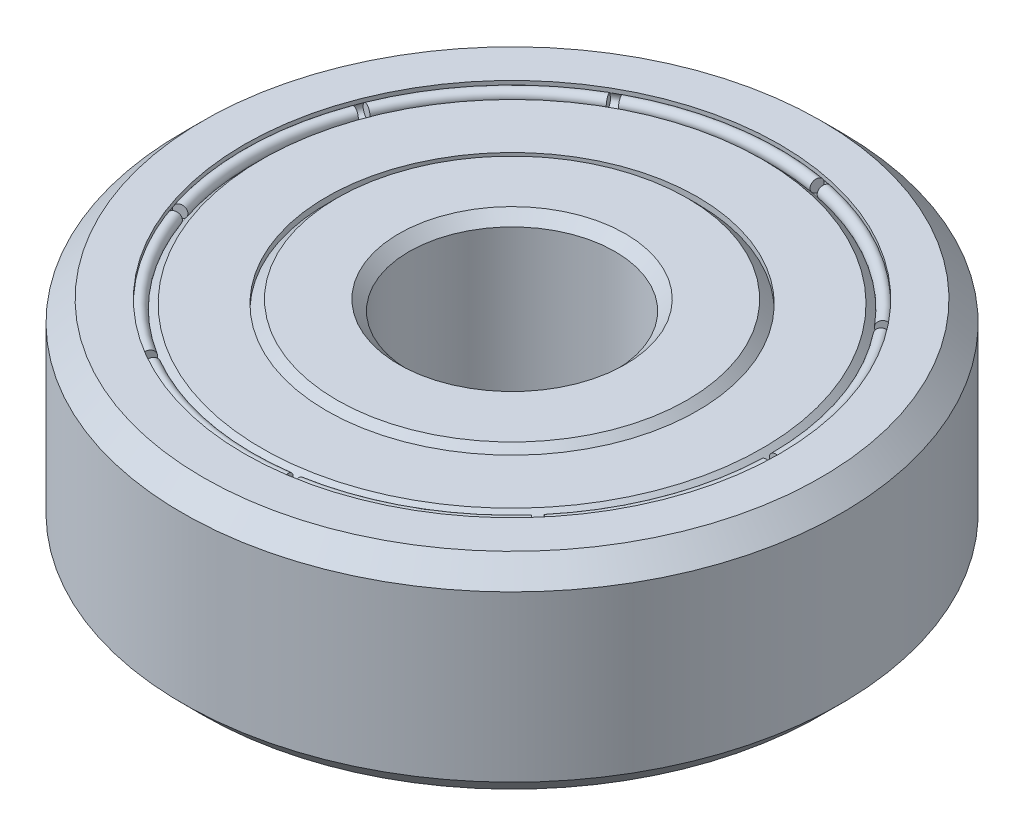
SolidWorks part; units mm, degrees
ref_plane "Front Plane" through (0, 0, 0) normal (0, 0, 1) x (1, 0, 0)
ref_plane "Top Plane" through (0, 0, 0) normal (0, 1, 0) x (1, 0, 0)
ref_plane "Right Plane" through (0, 0, 0) normal (1, 0, 0) x (0, 0, -1)
sketch "Sketch1" plane through (0, 0, 0) normal (0, 0, 1) x (1, 0, 0)
  line L0 (2.5, -2.25) -> (2.5, 2.25)
  line L1 (2.75, 2.5) -> (4.25, 2.5)
  line L2 (8, 2) -> (8, -2)
  line L3 (7.5, -2.5) -> (6.5, -2.5)
  line L4 (0, 0) -> (0, 2.5) construction
  line L5 (7.5, 2.5) -> (8, 2)
  line L6 (8, -2) -> (7.5, -2.5)
  line L7 (2.5, 0) -> (8, 0) construction
  line L8 (6.5, -2.5) -> (6.5, -2.4)
  line L9 (6.2879, -2.1879) -> (6.0757, -2.4)
  line L10 (6.0757, -2.4) -> (4.5, -2.4)
  line L11 (4.5, -2.4) -> (4.5, -2.25)
  line L12 (4.5, -2.25) -> (4.25, -2.5)
  line L13 (4.25, -2.5) -> (2.75, -2.5)
  line L14 (6.5, 2.5) -> (6.5, 2.4)
  line L15 (4.5, 2.25) -> (4.25, 2.5)
  line L16 (4.5, 2.4) -> (4.5, 2.25)
  line L17 (6.0757, 2.4) -> (4.5, 2.4)
  line L18 (6.2879, 2.1879) -> (6.0757, 2.4)
  line L19 (6.5, 2.5) -> (7.5, 2.5)
  line L20 (2.75, 2.5) -> (2.5, 2.25)
  line L21 (2.5, -2.25) -> (2.75, -2.5)
  line L22 (6.2879, -2.1879) -> (6.5, -2.4) construction
  arc A0 (6.5, -2.4) -> (6.2879, -2.1879) centre (6.3939, -2.2939) ccw
  arc A1 (6.5, 2.4) -> (6.2879, 2.1879) centre (6.3939, 2.2939) cw
  point P0 (0, 0)
  dimension "D10" = 0.15
  dimension "D1" = 5
  dimension "D2" = 16
  dimension "D3" = 5
  dimension "D4" = 0.5
  dimension "D5" = 13
  dimension "D6" = 9
  dimension "D7" = 0.1
  dimension "D8" = 8.5
  dimension "D11" = 0.1
  dimension "D12" = 0.25
revolve "Revolve1" add sketch "Sketch1" angle 360 about L4
sketch "Sketch2" plane through (0, 0, 0) normal (0, 0, 1) x (1, 0, 0)
  circle A0 centre (6.3939, -2.2939) radius 0.15
  arc A1 (6.5, -2.4) -> (6.2879, -2.1879) centre (6.3939, -2.2939) ccw construction
revolve "Revolve2" add sketch "Sketch2" angle 38 about L4
pattern_circular "CirPattern1" count 9 over 360 about axis through (0, 0, 0) along (0, 1, 0)
mirror "Mirror1" about plane through (0, 0, 0) normal (0, 1, 0)
